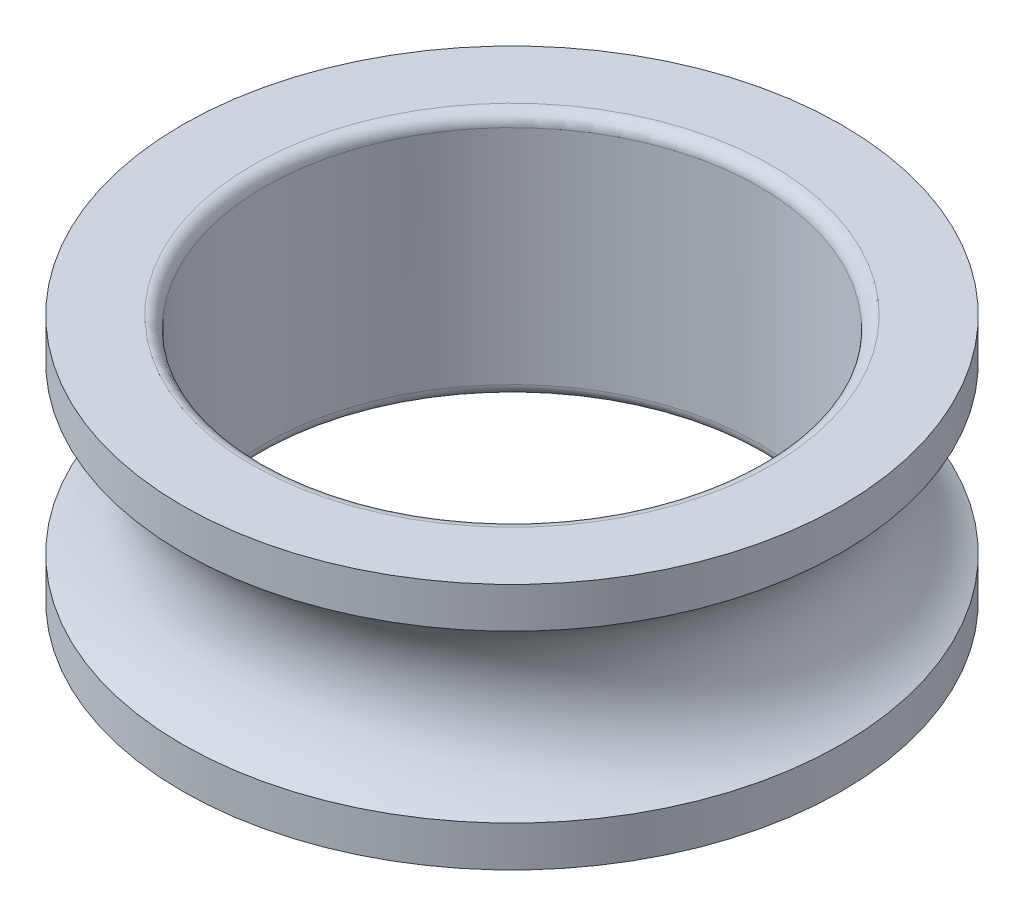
SolidWorks part; units mm, degrees
ref_plane "Plan de face" through (0, 0, 0) normal (0, 0, 1) x (1, 0, 0)
ref_plane "Plan de dessus" through (0, 0, 0) normal (0, 1, 0) x (1, 0, 0)
ref_plane "Plan de droite" through (0, 0, 0) normal (1, 0, 0) x (0, 0, -1)
ref_plane "Plan1" through (0, 0, 0) normal (0, 0, -1) x (-1, 0, 0)
sketch "Esquisse1" plane through (0, 0, 0) normal (0, 0, -1) x (-1, 0, 0)
  line L0 (-8, -3) -> (-6, -3)
  line L1 (-6, -3) -> (-6, 3)
  line L2 (-6, 3) -> (-8, 3)
  line L3 (-8, 3) -> (-8, 2.0156)
  line L4 (-8, -2.0156) -> (-8, -3)
  line L5 (0, -3) -> (0, 3) construction
  arc A0 (-8, 2.0156) -> (-8, -2.0156) centre (-9, 0) cw
revolve "Révolution1" add sketch "Esquisse1" angle 360 about L5
fillet "Congé1" radius 0.3 2 edges at (0, -3, 6) (0, 3, 6)
